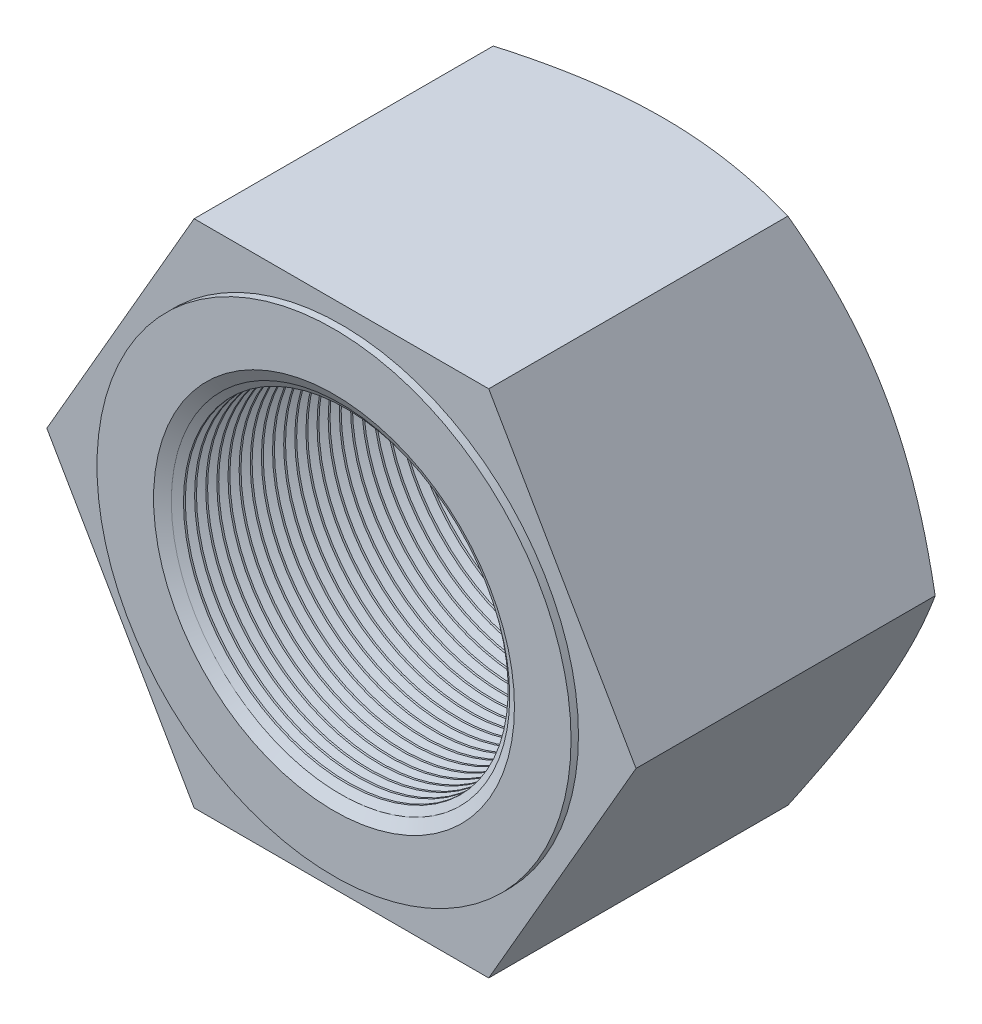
SolidWorks part; units mm, degrees
ref_plane "Front" through (0, 0, 0) normal (0, 0, 1) x (1, 0, 0)
ref_plane "Top" through (0, 0, 0) normal (0, 1, 0) x (1, 0, 0)
ref_plane "Right" through (0, 0, 0) normal (1, 0, 0) x (0, 0, -1)
sketch "Sketch1" plane through (0, 0, 0) normal (0, 0, 1) x (1, 0, 0)
  line L1 (15.8771, -27.5) -> (31.7543, 0)
  line L2 (31.7543, 0) -> (15.8771, 27.5)
  line L3 (15.8771, 27.5) -> (-15.8771, 27.5)
  line L4 (-15.8771, 27.5) -> (-31.7543, 0)
  line L5 (-31.7543, 0) -> (-15.8771, -27.5)
  line L6 (-15.8771, -27.5) -> (15.8771, -27.5)
  circle A0 centre (0, 0) radius 27.5 construction
  circle A1 centre (0, 0) radius 17.5
  dimension "D1" = 35
  dimension "s" = 55
extrude "BaseNut" add sketch "Sketch1" against normal blind 34.7
sketch "Sketch2" plane through (-16.7061, 0, -15.0481) normal (0, 1, 0) x (0, 0, 1)
  line L0 (-23.7227, 16.7061) -> (22.0646, 16.7061) construction
  line L2 (-19.6519, 44.2061) -> (-19.6519, 48.4604)
  line L4 (-19.6519, 48.4604) -> (-17.1957, 48.4604)
  line L6 (-17.1957, 48.4604) -> (-19.6519, 44.2061)
  dimension "D1" = 30
  dimension "S1" = 55
revolve "Chamfer1" cut sketch "Sketch2" angle 360 about L0
sketch "Sketch6" plane through (-9.1975, 0, -10.2525) normal (0, 1, 0) x (0, 0, 1)
  line L0 (23.3574, 9.1975) -> (-22.3023, 9.1975) construction
  line L2 (-24.4475, 26.6975) -> (-24.4475, 28.6475)
  line L4 (-24.4475, 28.6475) -> (-23.3216, 26.6975)
  line L6 (-23.3216, 26.6975) -> (-24.4475, 26.6975)
  dimension "da" = 38.9
  dimension "D2" = 60
revolve "EndChamfer1" cut sketch "Sketch6" angle 360 about L0
sketch "Sketch5" plane through (-14.793, 0, -16.9612) normal (0, 1, 0) x (0, 0, 1)
  line L0 (-22.5748, 14.793) -> (24.743, 14.793) construction
  line L2 (16.9612, 40.343) -> (16.9612, 46.5473)
  line L4 (16.9612, 46.5473) -> (13.3792, 46.5473)
  line L6 (13.3792, 46.5473) -> (16.9612, 40.343)
  dimension "dw1" = 51.1
  dimension "D2" = 30
revolve "Chamfer2" [suppressed] cut sketch "Sketch5" angle 360 about L0
sketch "Sketch3" plane through (-18.4892, 11.179, 0) normal (0, 0, 1) x (1, 0, 0)
  circle A1 centre (18.4892, -11.179) radius 17.5 construction
  circle A2 centre (18.4892, -11.179) radius 25.55
  circle A3 centre (18.4892, -11.179) radius 17.5
  dimension "dw" = 51.1
extrude "Extrude1" add sketch "Sketch3" along normal blind 0.8
chamfer "EndChamfer3" distance 1.95 angle 30 1 edges at (17.5, 0, 0.8)
chamfer "EndChamfer2" [suppressed] distance 1.1567 angle 45
sketch "Sketch7" plane through (0, 0, 0) normal (0, 1, 0) x (1, 0, 0)
  line L0 (0, 61.6098) -> (0, -22.305) construction
  line L1 (16.5, 34.0742) -> (17.5, 34.0742)
  line L2 (17.5, 34.0742) -> (18.366, 33.5742)
  line L3 (18.366, 33.5742) -> (17.5, 33.0742)
  line L4 (17.5, 33.0742) -> (16.5, 33.0742)
  line L5 (16.5, 33.0742) -> (16.5, 34.0742)
  line L6 (17.5, 33.5742) -> (-17.5, 33.5742) construction
  dimension "D1" = 1
  dimension "D2" = 35
revolve "Cut-Revolve10" cut sketch "Sketch7" angle 360 about L0
pattern_linear "LPattern10" count 29 spacing 1.2 along (0, 0, 1) of "Cut-Revolve10"
equation "\"D1@EndChamfer3\" = ( \"da@Sketch6\" - \"D1@Sketch1\" )  / 2"
equation "\"D1@EndChamfer2\" = \"m@BaseNut\" / 30"
equation "\"S1@Sketch2\" = \"s@Sketch1\""
equation "\"D2@Sketch7\" = \"D1@Sketch1\""
equation "\"D1@Sketch7\" = (  \"D2@ThreadCosmetic1\" - \"D1@Sketch1\" )  / 2"
equation "\"D3@LPattern10\" = \"D1@Sketch7\" * 1.2"
equation "\"D1@LPattern10\" =  \"m@BaseNut\"  / \"D3@LPattern10\""
